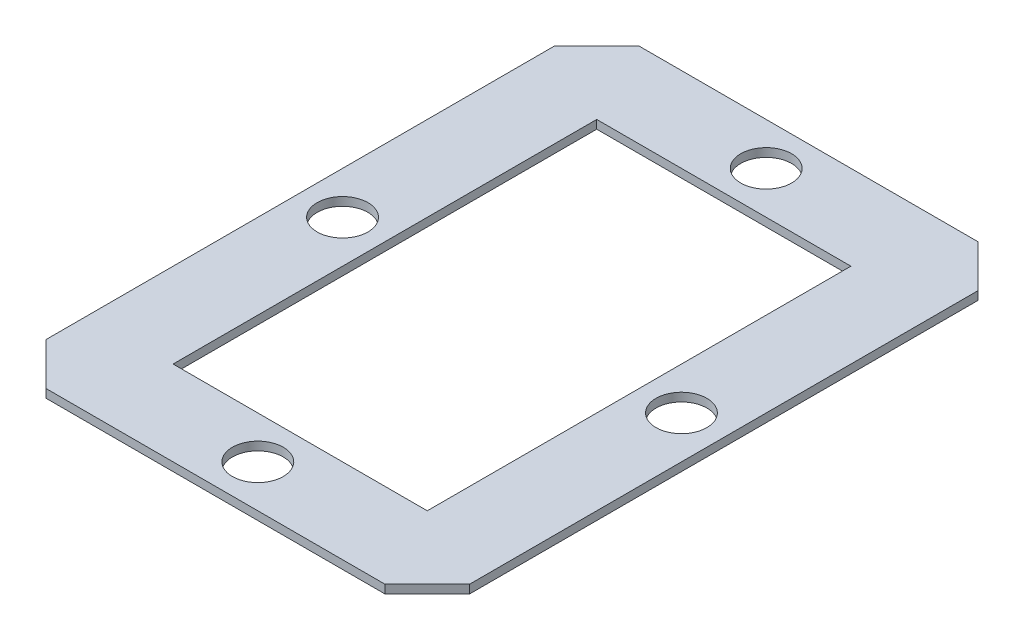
SolidWorks part; units mm, degrees
ref_plane "Спереди" through (0, 0, 0) normal (0, 0, 1) x (1, 0, 0)
ref_plane "Сверху" through (0, 0, 0) normal (0, 1, 0) x (1, 0, 0)
ref_plane "Справа" through (0, 0, 0) normal (1, 0, 0) x (0, 0, -1)
sketch "Sketch1" plane through (0, 0, 0) normal (0, 1, 0) x (1, 0, 0)
  line L0 (0, 72.0616) -> (0, -71.2071) construction
  line L1 (78.6127, 0) -> (-74.3402, 0) construction
  line L2 (-50, -70) -> (-50, 70)
  line L3 (-50, 70) -> (50, 70)
  line L4 (50, -70) -> (50, 70)
  line L5 (-50, -70) -> (50, -70)
  dimension "D1" = 140
  dimension "D2" = 100
extrude "Extrude1" add sketch "Sketch1" along normal blind 2
sketch "Sketch2" plane through (0, 2, 0) normal (0, 1, 0) x (1, 0, 0)
  line L0 (0, 76.5594) -> (0, -79.029) construction
  line L1 (96.8654, 0) -> (-89.1821, 0) construction
  circle A0 centre (0, 60) radius 6
  circle A1 centre (40, 0) radius 6
  circle A2 centre (0, -60) radius 6
  circle A3 centre (-40, 0) radius 6
  dimension "D1" = 120
  dimension "D2" = 12
  dimension "D4" = 40
  dimension "D5" = 40
extrude "Cut-Extrude1" cut sketch "Sketch2" against normal through all
chamfer "Chamfer1" distance 10 angle 45 4 edges at (-50, 1, -70) (50, 1, -70) (50, 1, 70) (-50, 1, 70)
sketch "Sketch3" plane through (0, 0, 0) normal (0, -1, 0) x (1, 0, 0)
  line L0 (0, 82.0686) -> (0, -95.6099) construction
  line L1 (109.8651, 0) -> (-83.4064, 0) construction
  line L2 (-30, -50) -> (-30, 50)
  line L3 (-30, 50) -> (30, 50)
  line L4 (-30, -50) -> (30, -50)
  line L5 (30, -50) -> (30, 50)
  dimension "D1" = 100
  dimension "D2" = 60
extrude "Cut-Extrude2" cut sketch "Sketch3" against normal up to next
